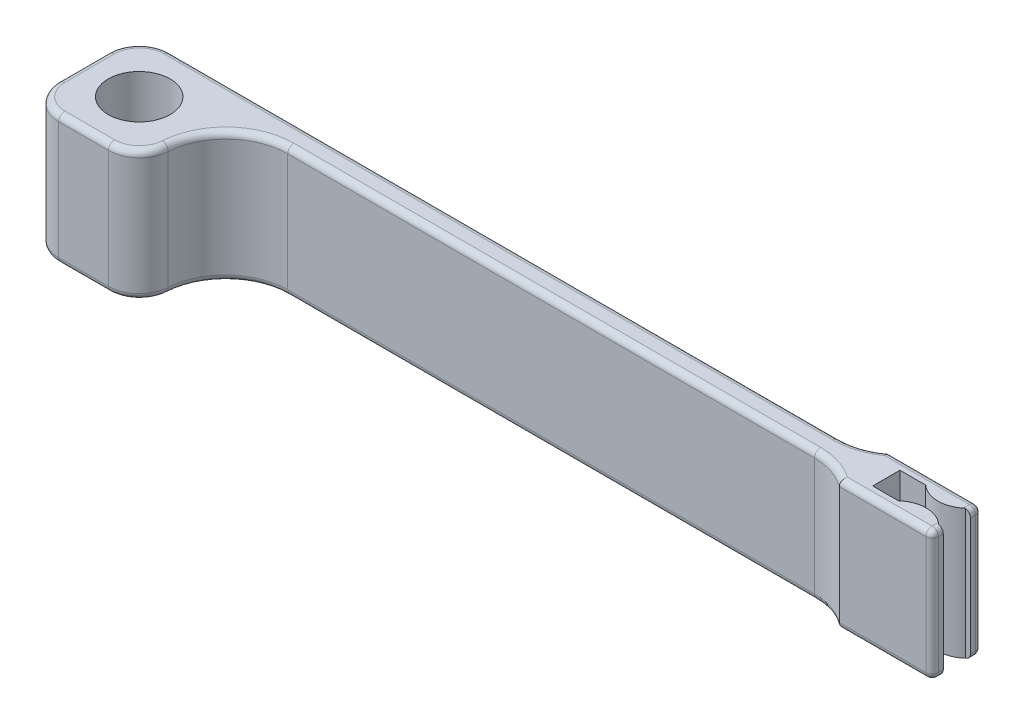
SolidWorks part; units mm, degrees
ref_plane "Front Plane" through (0, 0, 0) normal (0, 0, 1) x (1, 0, 0)
ref_plane "Top Plane" through (0, 0, 0) normal (0, 1, 0) x (1, 0, 0)
ref_plane "Right Plane" through (0, 0, 0) normal (1, 0, 0) x (0, 0, -1)
sketch "Sketch1" plane through (0, 0, 0) normal (0, 0, 1) x (1, 0, 0)
  line L1 (-150, 10.5) -> (150, 10.5)
  line L2 (-150, 10.5) -> (-150, -10.5)
  line L3 (-150, -10.5) -> (150, -10.5)
  line L4 (150, 10.5) -> (150, -10.5)
  line L5 (-150, 10.5) -> (150, -10.5) construction
  line L6 (-150, -10.5) -> (150, 10.5) construction
  point P0 (0, 0)
  dimension "D1" = 21
  dimension "D2" = 300
extrude "Boss-Extrude1" add sketch "Sketch1" along normal blind 4
sketch "Sketch2" plane through (0, 10.5, 0) normal (0, 1, 0) x (1, 0, 0)
  line L0 (-150, -4) -> (-150, -18)
  line L1 (-150, -18) -> (-168, -18)
  line L2 (-168, -18) -> (-168, 0)
  line L3 (-168, 0) -> (-150, 0)
  line L4 (-150, 0) -> (-150, -4)
  arc A0 (-154, -9) -> (-164, -9) centre (-159, -9) ccw
  arc A1 (-164, -9) -> (-154, -9) centre (-159, -9) ccw
  dimension "D3" = 10
  dimension "D1" = 5
  dimension "D6" = 9
  dimension "D7" = 9
  dimension "D4" = 10
  dimension "D2" = 5
  dimension "D5" = 9
  dimension "D8" = 9
extrude "Boss-Extrude2" add sketch "Sketch2" against normal up to surface (21 mm away)
fillet "Fillet2" radius 10 1 edges
fillet "Fillet3" radius 5 3 edges at (-150, 0, 18) (-168, 0, 18) (-168, 0, 0)
sketch "Sketch3" plane through (0, 0, 0) normal (0, 0, -1) x (-1, 0, 0)
  line L0 (-150, 10.5) -> (163, 10.5) construction
  line L1 (-150, -10.5) -> (-56.63, -10.5)
  line L2 (-150, -10.5) -> (-150, 10.5)
  line L3 (-150, 10.5) -> (-56.63, 10.5)
  line L4 (-56.63, -10.5) -> (-56.63, 10.5)
  dimension "D1" = 93.37
extrude "Cut-Extrude1" cut sketch "Sketch3" against normal blind 10
sketch "Sketch4" plane through (0, 10.5, 0) normal (0, 1, 0) x (1, 0, 0)
  line L0 (56.63, -2) -> (100.9468, -2) construction
  line L1 (56.63, -4) -> (56.63, 0) construction
  line L2 (56.63, 0) -> (73.2204, 0)
  line L3 (56.63, -4) -> (73.2204, -4)
  line L4 (56.63, 0) -> (56.63, -4)
  arc A0 (73.2208, 0.002) -> (73.2204, 0) centre (83.0184, -2) ccw
  arc A1 (73.0184, 0) -> (82.8159, 7.998) centre (73.0184, 10) ccw
  arc A2 (73.0184, -4) -> (82.8159, -11.998) centre (73.0184, -14) cw
  arc A3 (82.8159, -11.998) -> (82.8159, 7.998) centre (83.0184, -2) ccw
  arc A4 (73.2204, -4) -> (73.2208, -4.002) centre (83.0184, -2) ccw
  dimension "D1" = 20
  dimension "D2" = 20
  dimension "D3" = 10
  dimension "D4" = 10
extrude "Boss-Extrude3" add sketch "Sketch4" against normal up to surface (21 mm away) contours L0 L3 A4 A2 A3 M4 | L4 L0 A3 A1 A0 L2
sketch "Sketch5" plane through (0, 0, 0) normal (0, 0, -1) x (-1, 0, 0)
  line L0 (44.8898, -10.5) -> (44.8898, 10.5) construction
  line L1 (163, -10.5) -> (-73.2204, -10.5) construction
  line L2 (-73.2204, 10.5) -> (163, 10.5) construction
  line L3 (44.8898, 10.5) -> (11.3095, 56.2962) construction
  line L5 (44.8898, -10.5) -> (-131.681, -10.5)
  line L6 (44.8898, -10.5) -> (44.8898, 20.7736)
  line L7 (44.8898, 20.7736) -> (-131.681, 20.7736)
  line L8 (-131.681, -10.5) -> (-131.681, 20.7736)
extrude "Cut-Extrude2" cut sketch "Sketch5" against normal through all both and the other way through all
sketch "Sketch6" plane through (0, 10.5, 0) normal (0, 1, 0) x (1, 0, 0)
  line L0 (-44.8898, -2) -> (-19.1842, -2) construction
  line L1 (-44.8898, -4) -> (-44.8898, 0) construction
  line L3 (-44.8898, 0) -> (-163, 0) construction
  line L4 (-48.8898, 0) -> (-44.8898, 0)
  line L5 (-48.8898, 0) -> (-48.8898, 2)
  line L6 (-48.8898, 2) -> (-33.8898, 2)
  line L7 (-33.8898, 0.2) -> (-33.8898, 2)
  line L8 (-33.8898, 0) -> (-21.2871, 0) construction
  line L10 (-33.8898, -4.2) -> (-33.8898, -6)
  line L12 (-48.8898, -6) -> (-33.8898, -6)
  line L13 (-48.8898, -4) -> (-44.8898, -4)
  line L14 (-48.8898, -4) -> (-48.8898, -6)
  line L15 (-44.8898, 0.2) -> (-41.1205, 0.2)
  line L16 (-34.6591, 0.2) -> (-33.8898, 0.2)
  line L19 (-44.8898, -4.2) -> (-41.1205, -4.2)
  line L20 (-34.6591, -4.2) -> (-33.8898, -4.2)
  line L21 (-44.8898, -4) -> (-44.8898, -4.2)
  line L22 (-44.8898, 0) -> (-44.8898, 0.2)
  line L23 (-48.8898, 0.2) -> (-41.1205, 0.2) construction
  line L24 (-48.8898, -4.2) -> (-41.1205, -4.2) construction
  line L25 (-48.8898, -4) -> (-41.197, -4) construction
  line L26 (-48.8898, 0) -> (-41.197, 0) construction
  line L27 (-34.5826, -4) -> (-33.8898, -4) construction
  line L28 (-34.5826, 0) -> (-33.8898, 0) construction
  arc A2 (-41.1205, 0.2) -> (-34.6591, 0.2) centre (-37.8898, 3.75) ccw
  arc A3 (-41.1205, -4.2) -> (-34.6591, -4.2) centre (-37.8898, -7.75) cw
  arc A4 (-41.197, 0) -> (-34.5826, 0) centre (-37.8898, 3.75) ccw construction
  arc A5 (-41.197, -4) -> (-34.5826, -4) centre (-37.8898, -7.75) cw construction
  dimension "D4" = 2
  dimension "D5" = 4
  dimension "D8" = 0.2
  dimension "D9" = 0.2
extrude "Boss-Extrude4" add sketch "Sketch6" against normal up to surface (21 mm away)
fillet "Fillet4" radius 10 2 edges at (-48.8898, 0, 4) (-48.8898, 0, 0)
fillet "Fillet5" radius 1 2 edges at (-33.8898, 0, 6) (-33.8898, 0, -2)
fillet "Fillet7" radius 1 32 edges at (-33.8898, -10.5, -0.6) (-33.8898, 10.5, -0.6) (-34.1827, -10.5, -1.7071) (-34.1827, 10.5, -1.7071) (-33.8898, 10.5, 4.6) (-33.8898, -10.5, 4.6) (-34.1827, -10.5, 5.7071) (-34.1827, 10.5, 5.7071) (-51.7275, -10.5, -0.5132) (-108.9449, -10.5, 0) (-166.5355, -10.5, 1.4645) (-168, -10.5, 9) (-168, 10.5, 9) (-166.5355, -10.5, 16.5355) (-158.9833, -10.5, 18) (-158.9833, 10.5, 18) (-151.551, -10.5, 16.6515) (-146.8313, -10.5, 6.697) (-51.7275, -10.5, 4.5132) (-51.7275, 10.5, 4.5132) (-51.7275, 10.5, -0.5132) (-108.9449, 10.5, 0) (-166.5355, 10.5, 1.4645) (-166.5355, 10.5, 16.5355) (-151.551, 10.5, 16.6515) (-146.8313, 10.5, 6.697) (-41.8898, 10.5, -2) (-41.8898, -10.5, -2) (-41.8898, -10.5, 6) (-41.8898, 10.5, 6)
sketch "Sketch7" plane through (-44.8898, 0, 0) normal (1, 0, 0) x (0, 0, -1)
  line L1 (-4.2, -10.5) -> (0.2, -10.5)
  line L2 (-4.2, -10.5) -> (-4.2, 10.5)
  line L3 (-4.2, 10.5) -> (0.2, 10.5)
  line L4 (0.2, -10.5) -> (0.2, 10.5)
extrude "Cut-Extrude3" cut sketch "Sketch7" against normal blind 0.4
